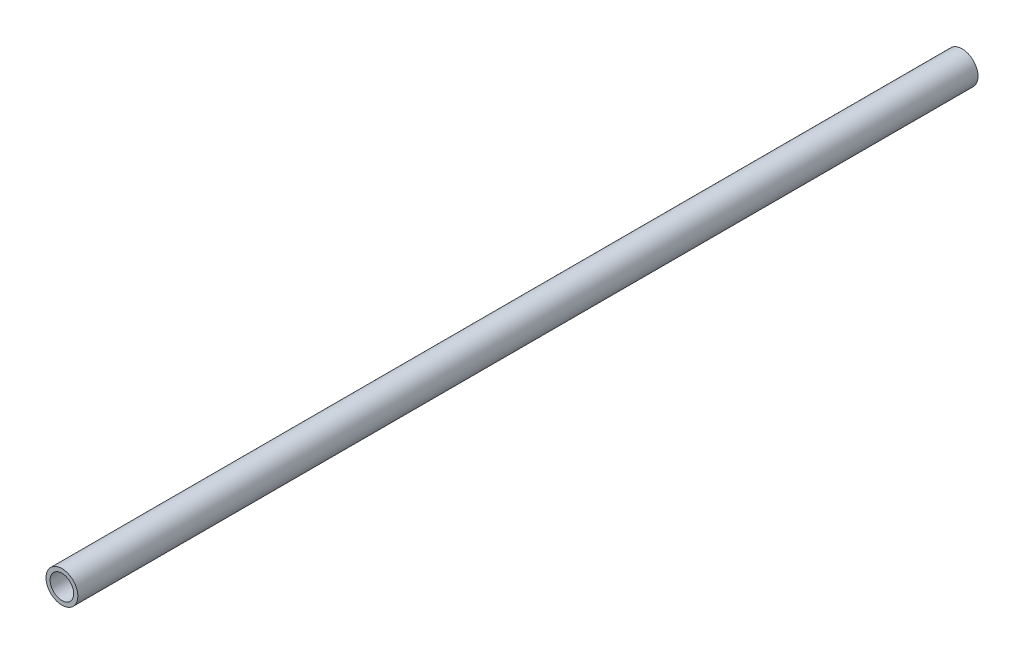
SolidWorks part; units mm, degrees
ref_plane "Front Plane" through (0, 0, 0) normal (0, 0, 1) x (1, 0, 0)
ref_plane "Top Plane" through (0, 0, 0) normal (0, 1, 0) x (1, 0, 0)
ref_plane "Right Plane" through (0, 0, 0) normal (1, 0, 0) x (0, 0, -1)
sketch "Sketch1" plane through (0, 0, 0) normal (0, 0, 1) x (1, 0, 0)
  circle A0 centre (0, 0) radius 10.7696
  circle A1 centre (0, 0) radius 8.001
  dimension "D1" = 21.5392
  dimension "D2" = 16.002
extrude "Boss-Extrude1" add sketch "Sketch1" along normal mid plane 609.6
